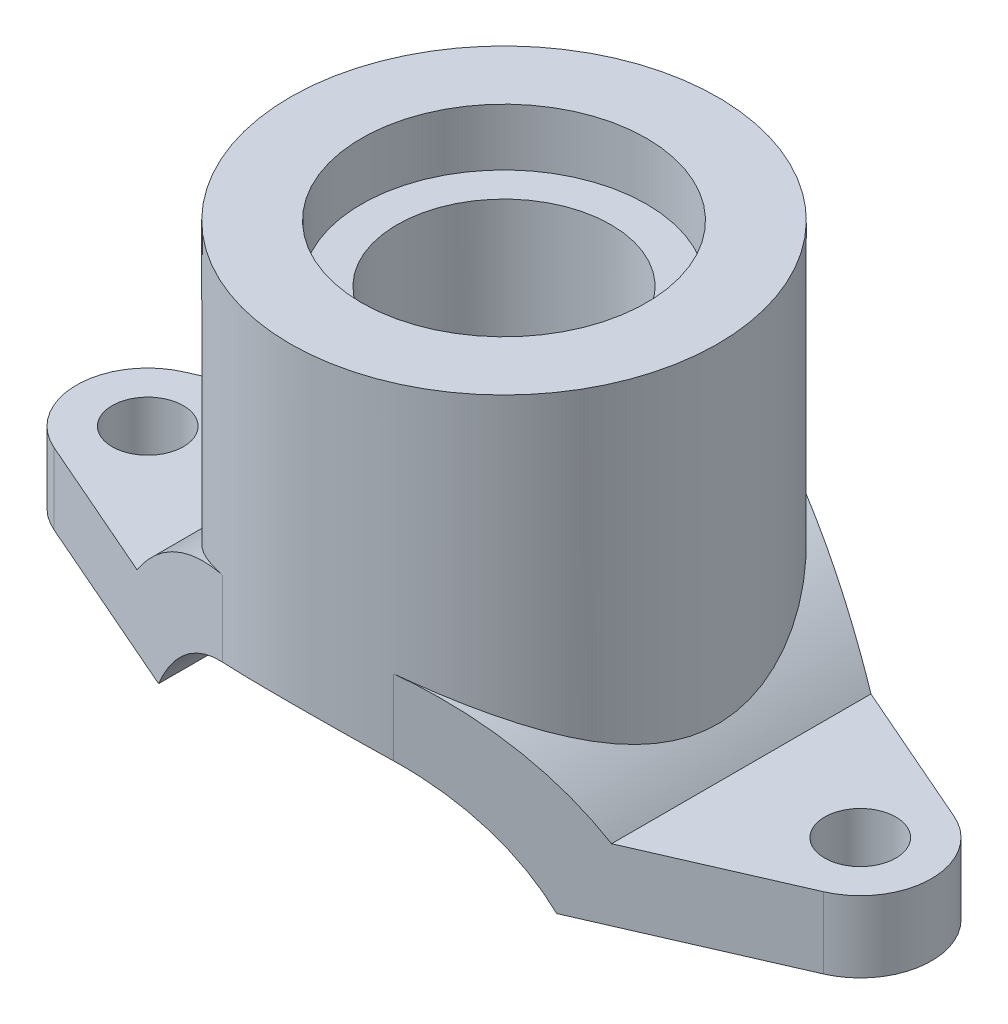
SolidWorks part; units mm, degrees
ref_plane "Front Plane" through (0, 0, 0) normal (0, 0, 1) x (1, 0, 0)
ref_plane "Top Plane" through (0, 0, 0) normal (0, 1, 0) x (1, 0, 0)
ref_plane "Right Plane" through (0, 0, 0) normal (1, 0, 0) x (0, 0, -1)
sketch "Sketch2" plane through (0, 0, 0) normal (0, 0, 1) x (1, 0, 0)
  line L0 (-150, 0) -> (-69.8498, 0)
  line L1 (69.8498, 0) -> (150, 0)
  line L2 (-150, 25) -> (-83.2406, 25)
  line L3 (83.2406, 25) -> (150, 25)
  line L4 (-150, 25) -> (-150, 0)
  line L5 (150, 25) -> (150, 0)
  line L6 (0, 0) -> (0, 155.6309) construction
  arc A0 (-69.8498, 0) -> (69.8498, 0) centre (0, -39) cw
  arc A1 (-83.2406, 25) -> (83.2406, 25) centre (0, -39) cw
  arc A2 (-83.2406, 25) -> (83.2406, 25) centre (0, -39) cw construction
  dimension "D3" = 39
  dimension "D6" = 300
  dimension "D2" = 105
  dimension "D1" = 80
  dimension "D5" = 25
extrude "Boss-Extrude1" add sketch "Sketch2" along normal mid plane 150
ref_plane "Plane1" through (0, 66, 75) normal (0, 1, 0) x (1, 0, 0)
sketch "Sketch3" plane through (0, 66, 75) normal (0, 1, 0) x (1, 0, 0)
  line L0 (-150, 0) -> (-150, 150) construction
  line L1 (0, 0) -> (0, 150) construction
  line L2 (-83.2406, 0) -> (83.2406, 0) construction
  line L3 (150, 0) -> (150, 150) construction
  line L4 (83.2406, 150) -> (-83.2406, 150) construction
  line L6 (-135, 97.9129) -> (-30, 143.7386)
  line L7 (30, 143.7386) -> (135, 97.9129)
  line L8 (135, 52.0871) -> (30, 6.2614)
  line L9 (-135, 52.0871) -> (-30, 6.2614)
  arc A0 (-135, 97.9129) -> (-135, 52.0871) centre (-125, 75) ccw
  arc A1 (135, 52.0871) -> (135, 97.9129) centre (125, 75) ccw
  arc A2 (-30, 6.2614) -> (30, 6.2614) centre (0, 75) ccw
  arc A3 (30, 143.7386) -> (-30, 143.7386) centre (0, 75) ccw
  dimension "D1" = 25
  dimension "D2" = 75
  dimension "D3" = 250
extrude "Cut-Extrude1" cut sketch "Sketch3" against normal through all flip side to cut
ref_plane "Plane2" through (0, 150, 0) normal (0, 1, 0) x (1, 0, 0)
sketch "Sketch4" plane through (0, 150, 0) normal (0, 1, 0) x (1, 0, 0)
  circle A0 centre (0, 0) radius 75
  dimension "D1" = 150
extrude "Boss-Extrude2" add sketch "Sketch4" against normal up to surface (84 mm away)
sketch "Sketch5" plane through (0, 0, 0) normal (0, 0, 1) x (1, 0, 0)
  line L0 (0, 0) -> (0, 186.9769) construction
  line L2 (0, 20) -> (0, 150)
  line L3 (0, 150) -> (50, 150)
  line L4 (50, 150) -> (50, 130)
  line L5 (50, 130) -> (37.5, 130)
  line L6 (37.5, 130) -> (37.5, 20)
  line L8 (37.5, 20) -> (0, 20)
  line L9 (75, 150) -> (-75, 150) construction
  dimension "D1" = 75
  dimension "D2" = 100
  dimension "D3" = 20
  dimension "D4" = 130
revolve "Cut-Revolve1" cut sketch "Sketch5" angle 360 about L0
sketch "Sketch6" plane through (0, 25, 0) normal (0, 1, 0) x (1, 0, 0)
  circle A0 centre (-125, 0) radius 12.5
  circle A1 centre (125, 0) radius 12.5
  dimension "D1" = 25
extrude "Cut-Extrude2" cut sketch "Sketch6" against normal through all
